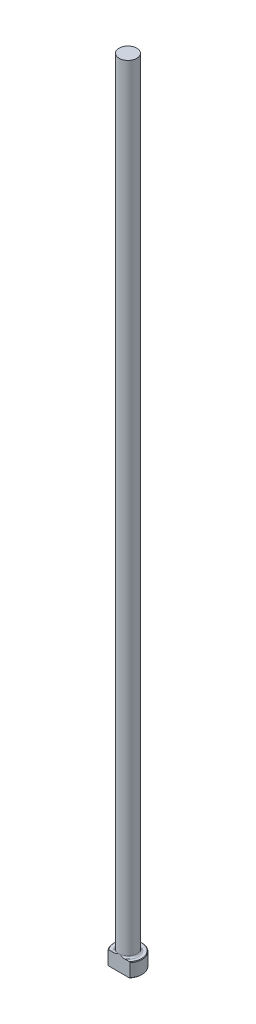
SolidWorks part; units mm, degrees
ref_plane "Front Plane" through (0, 0, 0) normal (0, 0, 1) x (1, 0, 0)
ref_plane "Top Plane" through (0, 0, 0) normal (0, 1, 0) x (1, 0, 0)
ref_plane "Right Plane" through (0, 0, 0) normal (1, 0, 0) x (0, 0, -1)
sketch "Sketch1" plane through (0, 0, 0) normal (0, 0, 1) x (1, 0, 0)
  line L0 (0, 259.9588) -> (0, -15.1925) construction
  line L1 (0, 0) -> (-6.35, 0)
  line L2 (-6.35, 0) -> (-6.35, 6.35)
  line L3 (-6.35, 6.35) -> (-3.9687, 6.35)
  line L4 (-3.9687, 6.35) -> (-3.9687, 355.6)
  line L5 (-3.9687, 355.6) -> (0, 355.6)
  line L6 (0, 355.6) -> (0, 0)
  dimension "L" = 355.6
  dimension "H" = 12.7
  dimension "T" = 6.35
  dimension "D" = 7.9375
revolve "Revolve1" add sketch "Sketch1" angle 360 about L0
chamfer "Chamfer1" distance 0.254 angle 45 2 edges at (0, 6.35, 6.35) (0, 0, 6.35)
fillet "Fillet1" radius 0.762 1 edges at (0, 6.35, 3.9687)
sketch "Sketch2" plane through (0, 0, 0) normal (0, -1, 0) x (1, 0, 0)
  line L0 (-4.957, 3.9687) -> (4.957, 3.9687)
  arc A0 (4.957, 3.9687) -> (-4.957, 3.9687) centre (0, 0) ccw
  circle A1 centre (0, 0) radius 6.35 construction
  circle A3 centre (0, 0) radius 3.9687 construction
extrude "KEY" cut sketch "Sketch2" against normal through all
sketch "Pocket Sketch" plane through (0, 0, 0) normal (0, 0, 1) x (1, 0, 0)
  line L0 (-6.7469, 0) -> (-6.7469, 6.3754)
  line L1 (-6.7469, 6.3754) -> (-5.1276, 6.3754)
  line L2 (-4.3656, 7.1374) -> (-4.3656, 22.225)
  line L3 (-4.3656, 22.225) -> (0, 22.225)
  line L4 (0, 22.225) -> (0, 0)
  line L5 (0, 0) -> (-6.7469, 0)
  line L6 (0, 12.6104) -> (0, -2.4989) construction
  line L7 (-6.35, 6.096) -> (-6.35, 0.254) construction
  line L8 (6.096, 6.35) -> (-6.096, 6.35) construction
  line L9 (-3.9687, 355.6) -> (-3.9687, 7.112) construction
  line L10 (-5.1276, 6.3754) -> (-4.3656, 7.1374)
  point P3 (-4.3656, 6.3754)
  dimension "D1" = 13.4937
  dimension "D2" = 0.3969
  dimension "D3" = 0.0254
  dimension "D4" = 0.3969
  dimension "D5" = 8.7312
  dimension "D6" = 22.225
